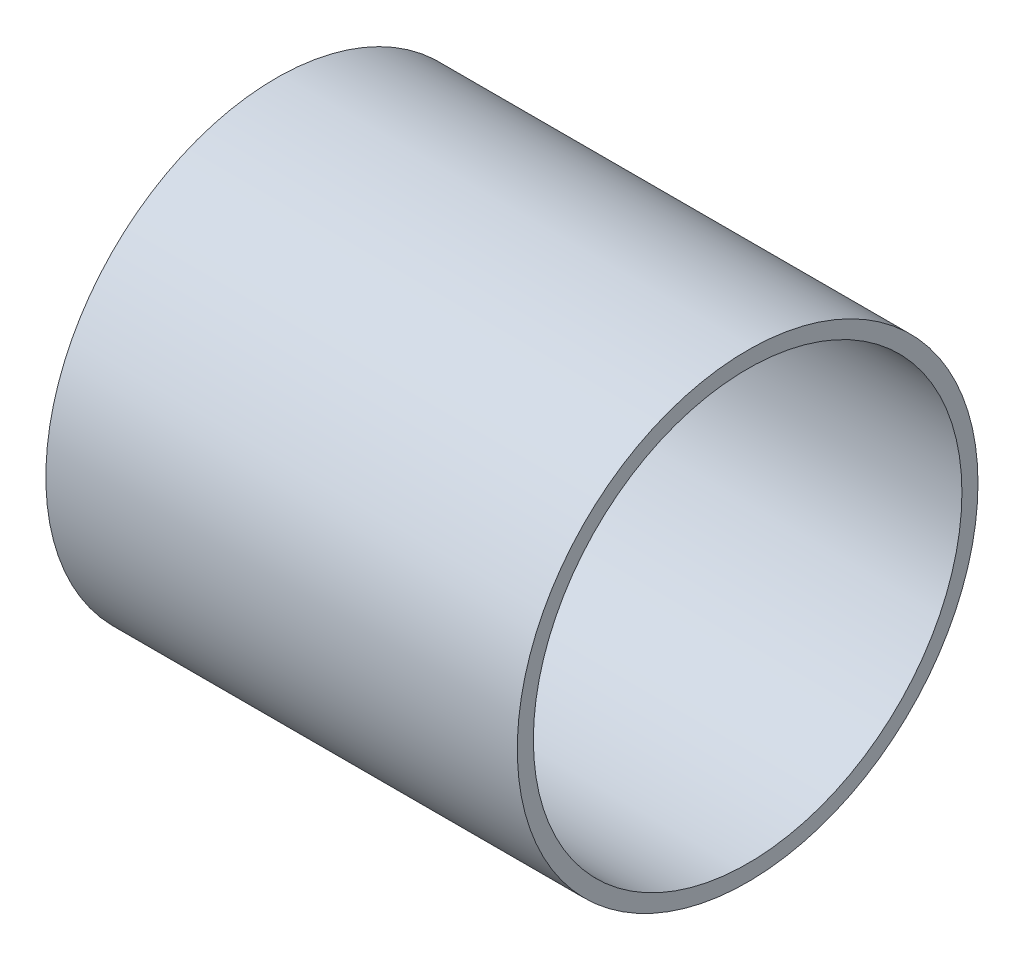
SolidWorks part; units mm, degrees
ref_plane "Front Plane" through (0, 0, 0) normal (0, 0, 1) x (1, 0, 0)
ref_plane "Top Plane" through (0, 0, 0) normal (0, 1, 0) x (1, 0, 0)
ref_plane "Right Plane" through (0, 0, 0) normal (1, 0, 0) x (0, 0, -1)
sketch "Sketch1" plane through (0, 0, 0) normal (1, 0, 0) x (0, 0, -1)
  circle A0 centre (0, 0) radius 127
  circle A1 centre (0, 0) radius 136.525
  dimension "D1" = 254
  dimension "D2" = 9.525
extrude "Extrude1" add sketch "Sketch1" along normal blind 279.4
